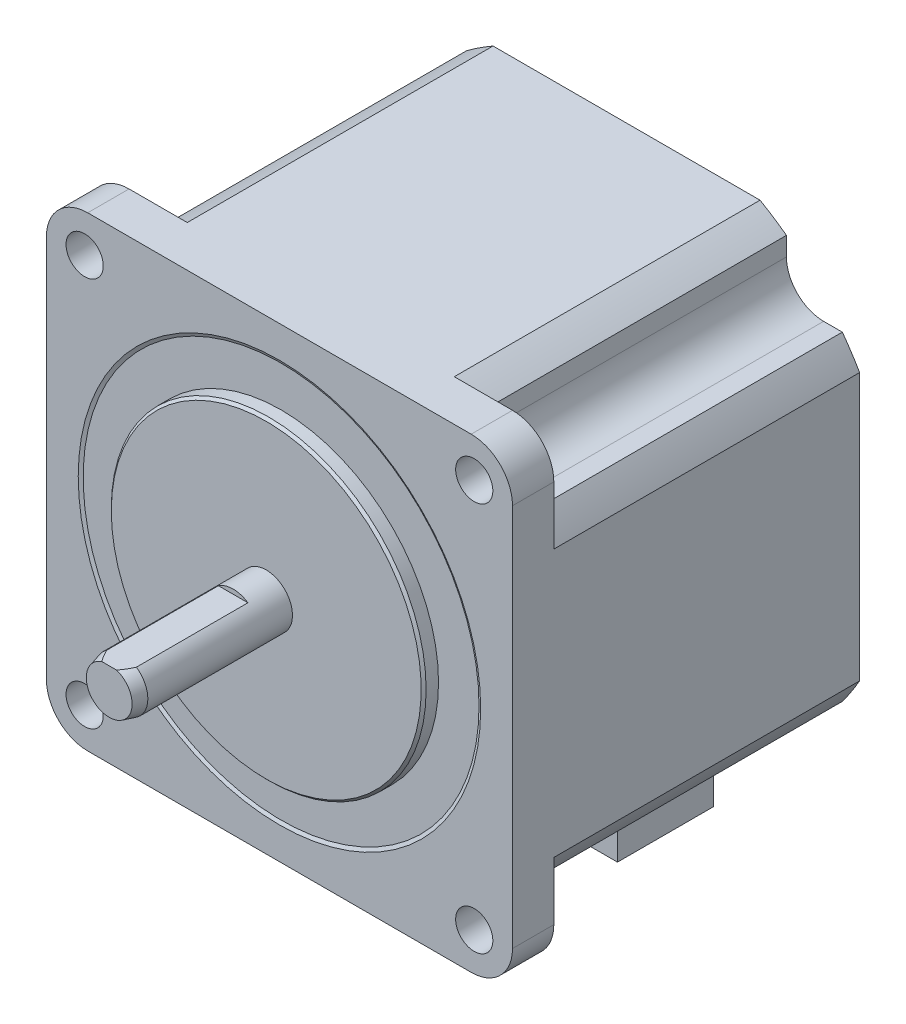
SolidWorks part; units mm, degrees
ref_plane "正面" through (0, 0, 0) normal (0, 0, 1) x (1, 0, 0)
ref_plane "平面" through (0, 0, 0) normal (0, 1, 0) x (1, 0, 0)
ref_plane "右側面" through (0, 0, 0) normal (1, 0, 0) x (0, 0, -1)
sketch "ｽｹｯﾁ1" plane through (0, 0, 0) normal (0, 0, 1) x (1, 0, 0)
  circle A0 centre (0, 0) radius 3.175
  dimension "D1" = 6.35
extrude "押し出し1" add sketch "ｽｹｯﾁ1" along normal blind 19
sketch "ｽｹｯﾁ2" plane through (0, 0, 0) normal (0, 0, -1) x (-1, 0, 0)
  circle A0 centre (0, 0) radius 19.05
  dimension "D1" = 38.1
extrude "押し出し2" add sketch "ｽｹｯﾁ2" along normal blind 1.6
sketch "ｽｹｯﾁ3" plane through (0, 0, -1.6) normal (0, 0, -1) x (-1, 0, 0)
  line L1 (-28.2, 28.2) -> (28.2, 28.2)
  line L2 (-28.2, 28.2) -> (-28.2, -28.2)
  line L3 (-28.2, -28.2) -> (28.2, -28.2)
  line L4 (28.2, 28.2) -> (28.2, -28.2)
  line L5 (-28.2, 28.2) -> (28.2, -28.2) construction
  line L6 (-28.2, -28.2) -> (28.2, 28.2) construction
  line L7 (23.57, 23.57) -> (-23.57, 23.57) construction
  line L8 (23.57, 23.57) -> (23.57, -23.57) construction
  line L9 (23.57, -23.57) -> (-23.57, -23.57) construction
  line L10 (-23.57, 23.57) -> (-23.57, -23.57) construction
  line L11 (23.57, 23.57) -> (-23.57, -23.57) construction
  line L12 (23.57, -23.57) -> (-23.57, 23.57) construction
  circle A0 centre (23.57, 23.57) radius 2.25
  circle A1 centre (-23.57, 23.57) radius 2.25
  circle A2 centre (23.57, -23.57) radius 2.25
  circle A3 centre (-23.57, -23.57) radius 2.25
  point P0 (0, 0)
  point P6 (0, 0)
  dimension "D3" = 47.14
  dimension "D4" = 47.14
  dimension "D6" = 4.5
  dimension "D1" = 56.4
  dimension "D2" = 56.4
extrude "押し出し3" add sketch "ｽｹｯﾁ3" along normal blind 5
fillet "Fillet1" radius 5 4 edges at (28.2, -28.2, -4.1) (-28.2, -28.2, -4.1) (-28.2, 28.2, -4.1) (28.2, 28.2, -4.1)
sketch "ｽｹｯﾁ4" plane through (0, 0, -6.6) normal (0, 0, -1) x (-1, 0, 0)
  line L0 (19.35, 19.35) -> (28.2, 19.35)
  line L1 (-19.35, 28.2) -> (19.35, 28.2)
  line L2 (-19.35, 28.2) -> (-19.35, 19.35)
  line L3 (-19.35, -28.2) -> (19.35, -28.2)
  line L4 (19.35, 28.2) -> (19.35, 19.35)
  line L5 (-19.35, 28.2) -> (19.35, -28.2) construction
  line L6 (-19.35, -28.2) -> (19.35, 28.2) construction
  line L7 (-28.2, 19.35) -> (-19.35, 19.35)
  line L8 (-28.2, 19.35) -> (-28.2, -19.35)
  line L9 (-28.2, -19.35) -> (-19.35, -19.35)
  line L10 (28.2, 19.35) -> (28.2, -19.35)
  line L11 (-28.2, 19.35) -> (28.2, -19.35) construction
  line L12 (-28.2, -19.35) -> (28.2, 19.35) construction
  line L13 (-19.35, -19.35) -> (-19.35, -28.2)
  line L14 (19.35, -19.35) -> (28.2, -19.35)
  line L15 (19.35, -19.35) -> (19.35, -28.2)
  circle A0 centre (0, 0) radius 32.5
  point P0 (0, 0)
  point P6 (0, 0)
  dimension "D5" = 65
  dimension "D1" = 38.7
  dimension "D2" = 56.4
  dimension "D3" = 56.4
  dimension "D4" = 38.7
extrude "押し出し4" add sketch "ｽｹｯﾁ4" along normal blind 37 contours L10 A0 L0 L4 L1 L2 L7 L8 L9 L13 L3 L15 L14
fillet "Fillet2" radius 4.5 4 edges at (19.35, -19.35, -25.1) (-19.35, -19.35, -25.1) (-19.35, 19.35, -25.1) (19.35, 19.35, -25.1)
sketch "Sketch1" plane through (0, -28.2, 0) normal (0, -1, 0) x (1, 0, 0)
  line L0 (16.1558, -43.6) -> (-16.1558, -43.6) construction
  line L1 (-10.5, -43.6) -> (10.5, -43.6)
  line L2 (-10.5, -43.6) -> (-10.5, -32)
  line L3 (-10.5, -32) -> (10.5, -32)
  line L4 (10.5, -43.6) -> (10.5, -32)
  dimension "D1" = 11.6
  dimension "D2" = 21
  dimension "D3" = 10.5
extrude "Extrude1" add sketch "Sketch1" along normal blind 10
chamfer "Chamfer5" distance 1.5 angle 15 1 edges at (3.175, 0, 19)
sketch "Sketch2" plane through (0, 0, 19) normal (0, 0, 1) x (1, 0, 0)
  line L1 (-4.7278, 5.1185) -> (3.4221, 5.1185)
  line L2 (-4.7278, 5.1185) -> (-4.7278, 2.625)
  line L3 (-4.7278, 2.625) -> (3.4221, 2.625)
  line L4 (3.4221, 5.1185) -> (3.4221, 2.625)
  dimension "D1" = 2.625
extrude "Extrude2" cut sketch "Sketch2" against normal blind 15
sketch "Sketch6" plane through (0, 0, -1.6) normal (0, 0, 1) x (1, 0, 0)
  circle A0 centre (0, 0) radius 19.05
  circle A1 centre (0, 0) radius 24.35
  dimension "D1" = 48.7
  dimension "D2" = 38.1
extrude "Extrude6" cut sketch "Sketch6" against normal blind 0.2
chamfer "Chamfer6" distance 0.2 distance2 0.4 1 edges at (24.35, 0, -1.8)
chamfer "Chamfer2" distance 0.3 angle 45 1 edges at (-19.05, 0, 0)
sketch "Sketch4" plane through (0, 0, -43.6) normal (0, 0, -1) x (-1, 0, 0)
  circle A0 centre (0, 0) radius 3.175
  dimension "D1" = 6.35
extrude "Extrude4" add sketch "Sketch4" along normal blind 16
sketch "Sketch5" plane through (0, 0, -59.6) normal (0, 0, -1) x (-1, 0, 0)
  line L1 (-2.9986, 5.5143) -> (3.3195, 5.5143)
  line L2 (-2.9986, 5.5143) -> (-2.9986, 2.625)
  line L3 (-2.9986, 2.625) -> (3.3195, 2.625)
  line L4 (3.3195, 5.5143) -> (3.3195, 2.625)
  dimension "D2" = 2.625
extrude "Extrude5" cut sketch "Sketch5" against normal blind 15
chamfer "Chamfer4" distance 1.5 angle 15 1 edges at (0, -3.175, -59.6)
